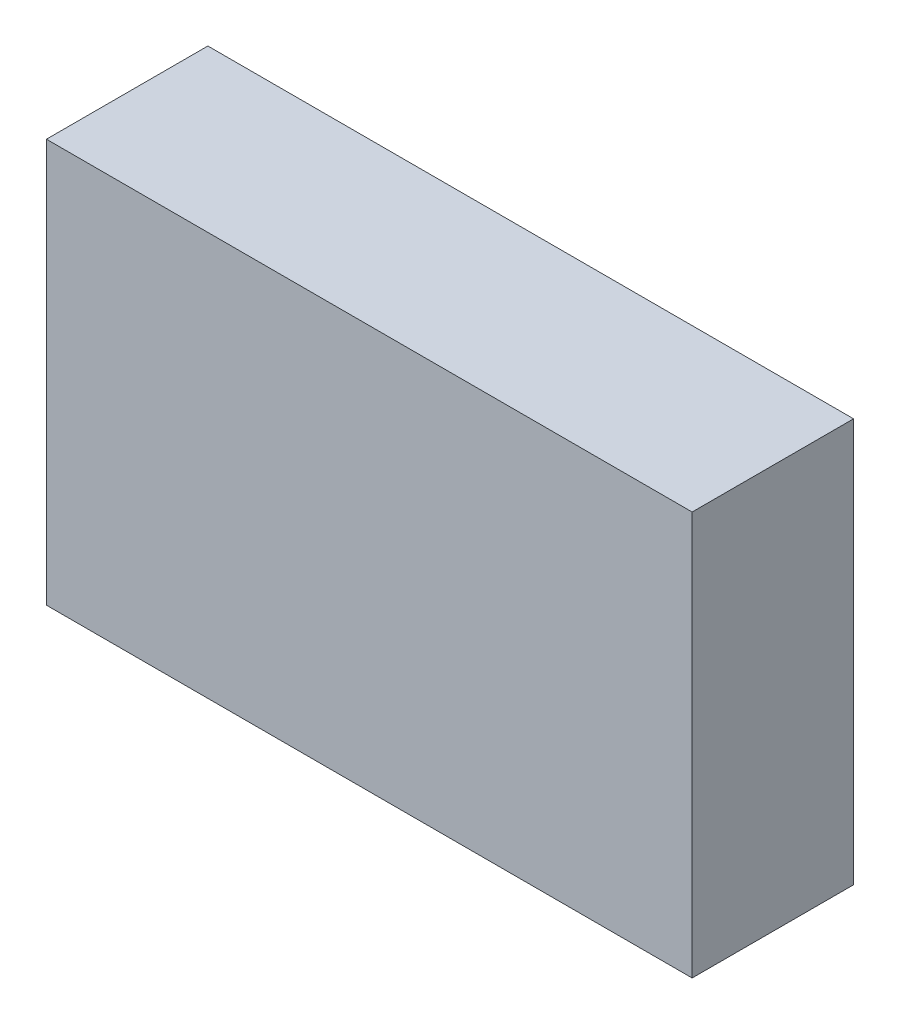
SolidWorks part; units mm, degrees
ref_plane "Front" through (0, 0, 0) normal (0, 0, 1) x (1, 0, 0)
ref_plane "Top" through (0, 0, 0) normal (0, 1, 0) x (1, 0, 0)
ref_plane "Right" through (0, 0, 0) normal (1, 0, 0) x (0, 0, -1)
sketch "Sketch1" plane through (0, 0, 0) normal (0, 0, 1) x (1, 0, 0)
  line L1 (0, 0) -> (101.6, 0)
  line L2 (0, 0) -> (0, 63.5)
  line L3 (0, 63.5) -> (101.6, 63.5)
  line L4 (101.6, 0) -> (101.6, 63.5)
  dimension "D1" = 101.6
  dimension "D2" = 63.5
extrude "Extrude1" add sketch "Sketch1" along normal blind 25.4
